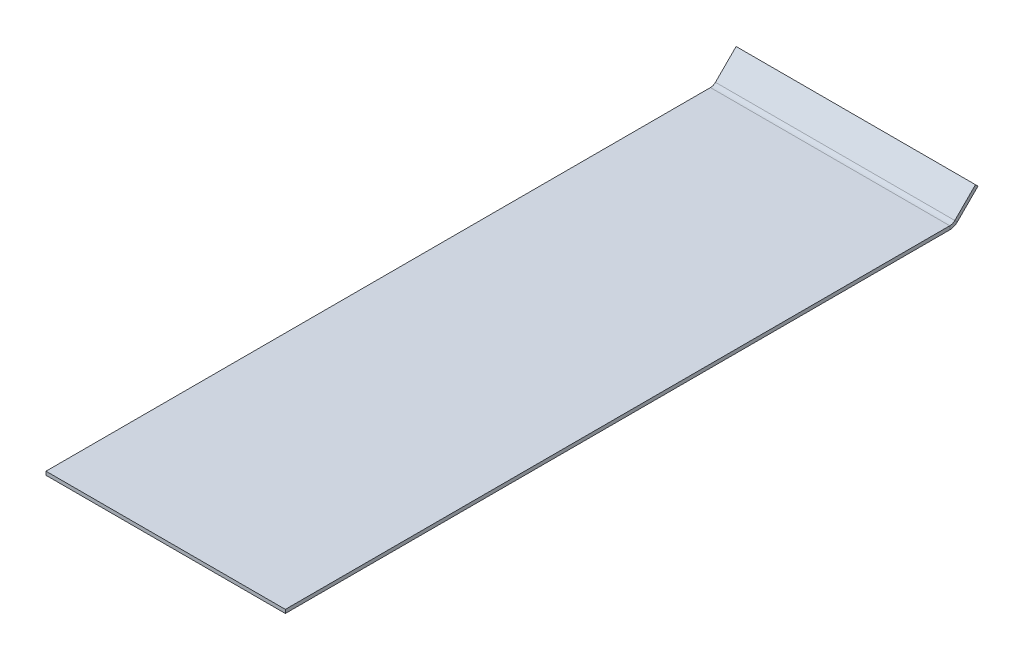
SolidWorks part; units mm, degrees
ref_plane "Front Plane" through (0, 0, 0) normal (0, 0, 1) x (1, 0, 0)
ref_plane "Top Plane" through (0, 0, 0) normal (0, 1, 0) x (1, 0, 0)
ref_plane "Right Plane" through (0, 0, 0) normal (1, 0, 0) x (0, 0, -1)
body saved out of another part "Stock-Piranha-h0400-4301-1"
flatten bends "Flatten-Bends1" thickness 1.524 parameters "D1"=0
sketch "Sharp-Sketch1" plane through (0, 27.7827, 0) normal (0, 1, 0) x (1, 0, 0)
  line L0 (392.3928, 243.0039) -> (290.7928, 243.0039) construction
bend "RoundBend1" bend radius 3 bend angle 45 parameters "D5"=1
process bends "Process-Bends1" thickness 1.524 parameters "D1"=0
sketch "Flat-Sketch1" plane through (0, 27.7827, 0) normal (0, 1, 0) x (1, 0, 0)
sketch "Bend-Lines1" plane through (0, 0, 0) normal (0, 1, 0) x (1, 0, 0)
sketch "Bounding-Box1" plane through (0, 0, 0) normal (0, 1, 0) x (1, 0, 0)
sheet metal parameters "Sheet-Metal2" thickness 1.524 parameters "D1"=3
flat pattern "Flat-Pattern2"
sketch "Bend-Lines2" plane through (0, 27.7827, 0) normal (0, 1, 0) x (1, 0, 0)
  line L0 (290.7928, 243.0039) -> (392.3928, 243.0039) construction
  line L1 (290.7928, 243.0039) -> (392.3928, 243.0039) construction
sketch3d "Bounding-Box2" [suppressed]
  line L0 (-101.6, 297.2772, 0) -> (-101.6, 0, 0) construction
  line L1 (0, 297.2772, 0) -> (0, 0, 0) construction
  line L2 (-101.6, 297.2772, 0) -> (0, 297.2772, 0) construction
  line L3 (-101.6, 0, 0) -> (0, 0, 0) construction
bend of the flat pattern "Flatten-<RoundBend1>1"
